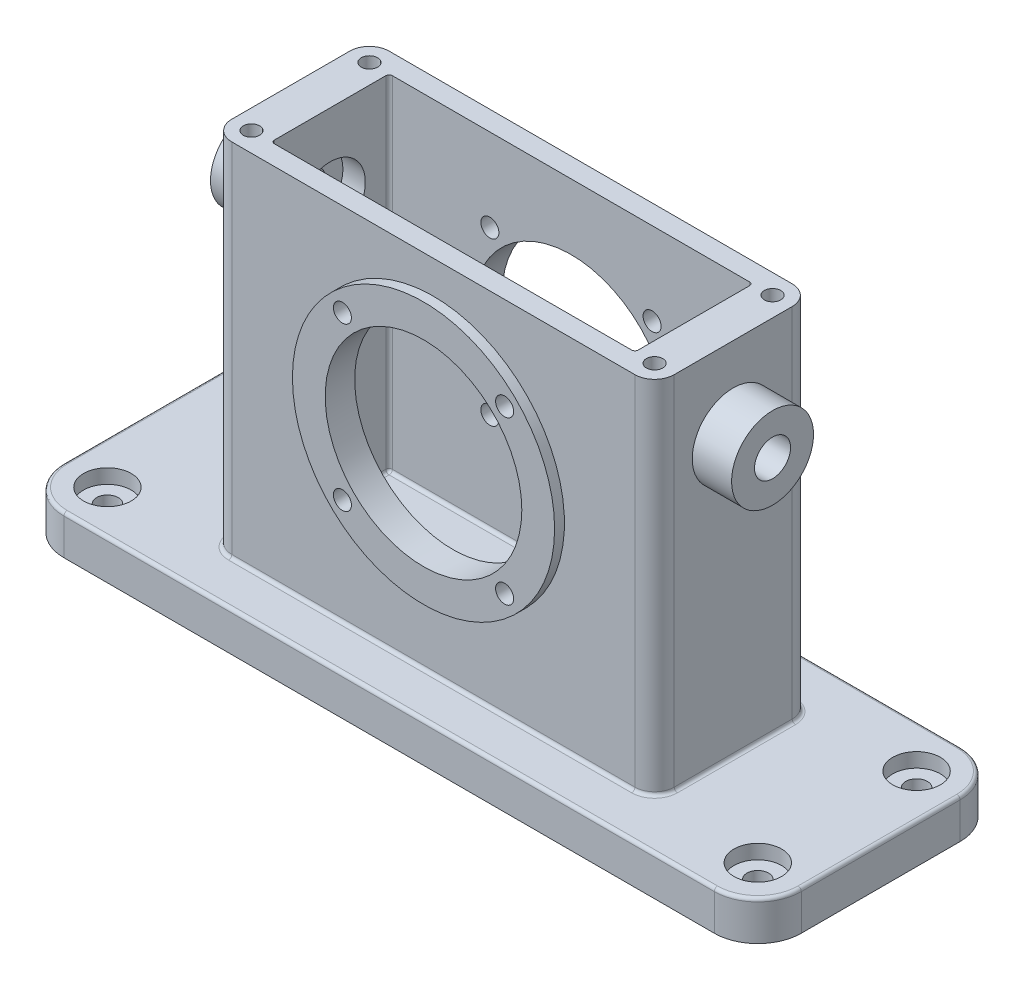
SolidWorks part; units mm, degrees
ref_plane "Front Plane" through (0, 0, 0) normal (0, 0, 1) x (1, 0, 0)
ref_plane "Top Plane" through (0, 0, 0) normal (0, 1, 0) x (1, 0, 0)
ref_plane "Right Plane" through (0, 0, 0) normal (1, 0, 0) x (0, 0, -1)
sketch "Sketch1" plane through (0, 0, 0) normal (0, 1, 0) x (1, 0, 0)
  line L1 (112.5, 37.5) -> (0, 37.5)
  line L2 (112.5, 37.5) -> (112.5, -37.5)
  line L3 (112.5, -37.5) -> (0, -37.5)
  line L4 (0, 37.5) -> (0, -37.5)
extrude "Plate" add sketch "Sketch1" along normal blind 12
sketch "Sketch2" plane through (0, 12, 0) normal (0, 1, 0) x (1, 0, 0)
  line L0 (0, -37.5) -> (0, 37.5) construction
  line L1 (0, 24) -> (67.5, 24)
  line L2 (0, 24) -> (0, -24)
  line L3 (0, -24) -> (67.5, -24)
  line L4 (67.5, 24) -> (67.5, -24)
extrude "Hsg" add sketch "Sketch2" along normal blind 110
sketch "Sketch3" plane through (67.5, 0, 0) normal (1, 0, 0) x (0, 0, -1)
  line L0 (0, 67.1) -> (0, -67.1) construction
  line L1 (-24, 122) -> (24, 122) construction
  circle A0 centre (0, 97) radius 12.5
  dimension "D1" = 25
  dimension "D2" = 25
extrude "Sm Cir Boss" add sketch "Sketch3" along normal blind 12
sketch "Sketch4" plane through (0, 122, 0) normal (0, 1, 0) x (1, 0, 0)
  line L0 (0, 24) -> (0, -24) construction
  line L1 (0, -18) -> (55.5, -18)
  line L2 (0, -18) -> (0, 18)
  line L3 (0, 18) -> (55.5, 18)
  line L4 (55.5, -18) -> (55.5, 18)
  line L5 (67.5, -24) -> (67.5, 24) construction
  line L6 (67.5, 24) -> (0, 24) construction
  line L7 (0, -24) -> (67.5, -24) construction
  dimension "D1" = 12
  dimension "D2" = 6
  dimension "D3" = 6
extrude "Inner Cut" cut sketch "Sketch4" against normal offset from surface (105 mm away) 5
hole_wizard "CBORE for M10 Hex Head Bolt1" positions "Sketch6" profile "Sketch5" counterbore size "M10" standard "ANSI Metric"
sketch "Sketch6" plane through (55.5, 0, 0) normal (-1, 0, 0) x (0, 0, 1)
  point P0 (0, 97)
sketch "Sketch5" plane through (55.5, 97, 0) normal (0, 1, 0) x (0, 0, 1)
  line L0 (0, 0) -> (0, 57)
  line L1 (0, 57) -> (5.5, 57)
  line L3 (5.5, 57) -> (5.5, 6.85)
  line L4 (5.5, 6.85) -> (10.74, 6.85)
  line L5 (10.74, 6.85) -> (10.74, 0)
  line L7 (10.74, 0) -> (0, 0)
  line L11 (0, -6.35) -> (0, 107.95) construction
  dimension "Thru Hole Dia." = 11
  dimension "Thru Hole Depth" = 57
  dimension "C'Bore Dia." = 21.48
  dimension "C'Bore Depth" = 6.85
fillet "Fillet1" radius 13.275 2 edges at (112.5, 6, -37.5) (112.5, 6, 37.5)
fillet "Fillet2" radius 1 5 edges at (49.6125, 12, -37.5) (108.6118, 12, -33.6118) (112.5, 12, 0) (108.6118, 12, 33.6118) (49.6125, 12, 37.5)
fillet "Fillet3" radius 6 2 edges at (67.5, 67, -24) (67.5, 67, 24)
fillet "Fillet4" radius 1 5 edges at (65.7426, 12, -22.2426) (67.5, 12, 0) (65.7426, 12, 22.2426)
fillet "Fillet5" radius 1 2 edges at (55.5, 69.5, 18) (55.5, 69.5, -18)
fillet "Fillet6" radius 1 5 edges at (27.25, 17, 18) (55.2071, 17, 17.7071) (55.5, 17, 0) (55.2071, 17, -17.7071) (27.25, 17, -18)
hole_wizard "Ø5.0 (5) Diameter Hole1" positions "Sketch8" profile "Sketch7" hole size "Ø5.0" standard "ANSI Metric"
sketch "Sketch8" plane through (0, 122, 0) normal (0, 1, 0) x (1, 0, 0)
  point P0 (61.5, -18)
  point P3 (61.5, 18)
sketch "Sketch7" plane through (61.5, 122, 18) normal (1, 0, 0) x (0, 0, 1)
  line L0 (0, 0) -> (0, 11.5022)
  line L1 (0, 11.5022) -> (2.5, 10)
  line L2 (2.5, 10) -> (2.5, 0)
  line L5 (2.5, 0) -> (0, 0)
  line L10 (0, 11.5022) -> (-2.5, 10) construction
  line L11 (0, -6.35) -> (0, 107.95) construction
  dimension "Hole Dia." = 5
  dimension "Hole Depth" = 10
  dimension "Drill Angle" = 118
hole_wizard "CBORE for M6 Hex Head Bolt1" positions "Sketch10" profile "Sketch9" counterbore size "M6" standard "ANSI Metric"
sketch "Sketch10" plane through (0, 12, 0) normal (0, 1, 0) x (1, 0, 0)
  point P0 (99.225, -24.225)
  point P3 (99.225, 24.225)
sketch "Sketch9" plane through (99.225, 12, 24.225) normal (1, 0, 0) x (0, 0, 1)
  line L0 (0, 0) -> (0, 12)
  line L1 (0, 12) -> (3.3, 12)
  line L3 (3.3, 12) -> (3.3, 4.38)
  line L4 (3.3, 4.38) -> (7.275, 4.38)
  line L5 (7.275, 4.38) -> (7.275, 0)
  line L7 (7.275, 0) -> (0, 0)
  line L11 (0, -6.35) -> (0, 107.95) construction
mirror "Mirror1" about plane through (0, 12, -37.5) normal (1, 0, 0)
sketch "Sketch11" plane through (0, 0, 24) normal (0, 0, 1) x (1, 0, 0)
  line L0 (0, -41.25) -> (0, 41.25) construction
  line L1 (-61.5, 122) -> (61.5, 122) construction
  circle A0 centre (0, 72) radius 40
  dimension "D1" = 50
  dimension "D2" = 80
extrude "Lg Cir Boss" add sketch "Sketch11" along normal blind 3
mirror "Mirror2" about plane through (0, 0, 0) normal (0, 0, 1) of "Lg Cir Boss"
sketch "Sketch12" plane through (0, 0, 27) normal (0, 0, 1) x (1, 0, 0)
  circle A0 centre (0, 72) radius 30
  dimension "D1" = 60
extrude "Lg Thru Hole" cut sketch "Sketch12" against normal through all
sketch "Sketch13" plane through (0, 0, 27) normal (0, 0, 1) x (1, 0, 0)
  circle A0 centre (0, 72) radius 35 construction
  dimension "D1" = 70
hole_wizard "Ø5.5 (5.5) Diameter Hole1" positions "Sketch15" profile "Sketch14" hole size "Ø5.5" standard "ANSI Metric"
sketch "Sketch15" plane through (0, 0, 27) normal (0, 0, 1) x (1, 0, 0)
  line L0 (0, 72) -> (35, 72) construction
  line L1 (0, 72) -> (24.7487, 96.7487) construction
  line L3 (0, 72) -> (24.7487, 47.2513) construction
  line L4 (-24.7487, 47.2513) -> (0, 72) construction
  line L5 (0, 72) -> (-24.7487, 96.7487) construction
  circle A0 centre (0, 72) radius 35 construction
  point P0 (24.7487, 96.7487)
  point P4 (24.7487, 47.2513)
  point P6 (-24.7487, 47.2513)
  point P8 (-24.7487, 96.7487)
  dimension "D1" = 45
sketch "Sketch14" plane through (24.7487, 96.7487, 27) normal (1, 0, 0) x (0, -1, 0)
  line L0 (0, 0) -> (0, 64.5)
  line L1 (0, 64.5) -> (2.75, 64.5)
  line L2 (2.75, 64.5) -> (2.75, 0)
  line L5 (2.75, 0) -> (0, 0)
  line L11 (0, -6.35) -> (0, 107.95) construction
  dimension "Thru Hole Dia." = 5.5
  dimension "Thru Hole Depth" = 64.5
equation "\"Sm_Rad\"= 1'Fillet Radius, small fillets"
equation "\"D1@Fillet2\"=\"Sm_Rad\""
equation "\"D1@Fillet4\"=\"Sm_Rad\""
equation "\"D1@Fillet5\"=\"Sm_Rad\""
equation "\"D1@Fillet6\"=\"Sm_Rad\""
equation "\"overall_boss\"= 135"
equation "\"overall_base\"= 225"
equation "\"D2@Sketch1\"=\"overall_base\"/2"
equation "\"D1@Sketch2\"=\"overall_boss\"/2"
equation "\"min_edge_dist\"= 6"
equation "\"D1@Fillet1\" = \"min_edge_dist\" + \"C'Bore Dia.@Sketch9\" / 2 ''''''''''''''''''''''''''''''''''''"
